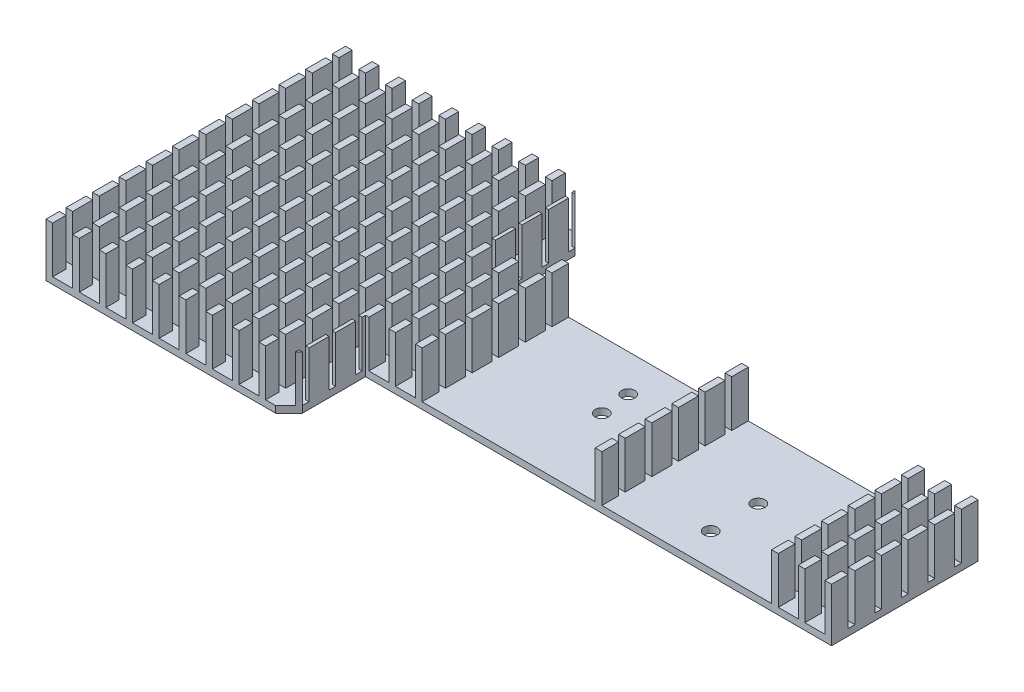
SolidWorks part; units mm, degrees
ref_plane "Plan de face" through (0, 0, 0) normal (0, 0, 1) x (1, 0, 0)
ref_plane "Plan de dessus" through (0, 0, 0) normal (0, 1, 0) x (1, 0, 0)
ref_plane "Plan de droite" through (0, 0, 0) normal (1, 0, 0) x (0, 0, -1)
sketch "Esquisse1" plane through (0, 0, 0) normal (0, 1, 0) x (1, 0, 0)
  line L0 (-33, 22) -> (-33, 19.5)
  line L1 (-40, 0) -> (-40, 19.5)
  line L2 (-33, 22) -> (30, 22)
  line L4 (30, 22) -> (30, 0)
  line L5 (-33, 19.5) -> (-40, 19.5)
  line L7 (-40, 0) -> (30, 0)
  dimension "D1" = 19.5
  dimension "D3" = 2.5
  dimension "D4" = 7
  dimension "D5" = 63
  dimension "D7" = 30
extrude "Boss.-Extru.1" add sketch "Esquisse1" along normal blind 1
sketch "Esquisse3" plane through (0, 1, 0) normal (0, 1, 0) x (1, 0, 0)
  line L0 (30, 0) -> (30, 22) construction
  line L1 (-40, -11.5) -> (-76.5, -11.5)
  line L2 (-40, 33.5) -> (-40, -11.5)
  line L3 (-40, 33.5) -> (-76.5, 33.5)
  line L4 (-76.5, -11.5) -> (-76.5, 33.5)
  line L6 (-33, 19.5) -> (-40, 19.5) construction
  line L7 (-40, 19.5) -> (-40, 0) construction
  dimension "D1" = 45
  dimension "D2" = 14
  dimension "D3" = 106.5
extrude "Boss.-Extru.2" add sketch "Esquisse3" against normal up to surface (1 mm away)
sketch "Esquisse4" plane through (0, 1, 0) normal (0, 1, 0) x (1, 0, 0)
  line L2 (30, 0) -> (30, 22) construction
  line L3 (-40, 0) -> (30, 0) construction
  circle A0 centre (7, 12) radius 1
  circle A1 centre (-16.5, 12) radius 1
  dimension "D1" = 2
  dimension "D2" = 2
  dimension "D3" = 23
  dimension "D4" = 23.5
  dimension "D5" = 12
extrude "Enlèv. mat.-Extru.2" cut sketch "Esquisse4" against normal through all
chamfer "Chanfrein3" distance 2 angle 45 2 edges at (-40, 0.5, -33.5) (-40, 0.5, 11.5)
sketch "Esquisse7" plane through (0, 0, 11.5) normal (0, 0, 1) x (1, 0, 0)
  line L0 (-76.5, 1) -> (-76.5, 15)
  line L3 (-75.5, 1) -> (-76.5, 1)
  line L4 (-75.5, 1) -> (-75.5, 15)
  line L5 (-75.5, 15) -> (-76.5, 15)
  dimension "D2" = 14
  dimension "D1" = 1
extrude "Boss.-Extru.3" add sketch "Esquisse7" against normal up to surface (45 mm away)
pattern_linear "Répétition linéaire1" count 12 spacing 4 along (1, 0, 0) of "Boss.-Extru.3"
sketch "Esquisse9" plane through (0, 1, 0) normal (0, -1, 0) x (1, 0, 0)
  line L0 (-33, -19.5) -> (-40, -19.5)
  line L1 (-40, -19.5) -> (-40, -31.5)
  line L2 (-40, -31.5) -> (-42, -33.5)
  line L3 (-40.5, -32) -> (-42, -33.5) construction
  line L4 (-42, -33.5) -> (30, -33.5)
  line L5 (30, -33.5) -> (30, -22)
  line L6 (30, -22) -> (-33, -22)
  line L7 (30, -22) -> (-31.5, -22) construction
  line L8 (-33, -22) -> (-33, -19.5)
  line L9 (-40, 0) -> (-40, 9.5)
  line L10 (-40, 9.5) -> (-42, 11.5)
  line L11 (-42, 11.5) -> (30, 11.5)
  line L13 (30, 11.5) -> (30, 0)
  line L14 (30, 0) -> (-40, 0)
  line L15 (-76.5, -33.5) -> (-42, -33.5) construction
extrude "Enlèv. mat.-Extru.3" cut sketch "Esquisse9" against normal through all
sketch "Esquisse10" plane through (0, 0, 0) normal (0, 0, 1) x (1, 0, 0)
  line L0 (30, 1) -> (30, 15)
  line L1 (30, 15) -> (29, 15)
  line L2 (29, 15) -> (29, 1)
  line L3 (-35.5, 1) -> (-32.5, 1) construction
  line L4 (29, 1) -> (30, 1)
  line L5 (-35.5, 15) -> (-36.5, 15) construction
  dimension "D1" = 1
extrude "Boss.-Extru.4" add sketch "Esquisse10" against normal up to surface (22 mm away)
pattern_linear "Répétition linéaire2" count 3 spacing 4 along (-1, 0, 0) of "Boss.-Extru.4"
sketch "Esquisse11" plane through (0, 1, 0) normal (0, 1, 0) x (1, 0, 0)
  circle A0 centre (-16.995, 16.45) radius 1
  circle A1 centre (6.995, 4.85) radius 1
  dimension "D1" = 2
  dimension "D2" = 2
extrude "Enlèv. mat.-Extru.4" cut sketch "Esquisse11" against normal through all
sketch "Esquisse12" plane through (0, 0, -22) normal (0, 0, -1) x (-1, 0, 0)
  line L0 (-21, 1) -> (31.5, 1) construction
  line L1 (4.5, 1) -> (5.5, 1)
  line L2 (4.5, 1) -> (4.5, 15)
  line L3 (4.5, 15) -> (5.5, 15)
  line L4 (5.5, 1) -> (5.5, 15)
  line L5 (5, 9.2012) -> (5, -0.9846) construction
  dimension "D1" = 1
  dimension "D2" = 14
extrude "Boss.-Extru.5" add sketch "Esquisse12" against normal up to surface (22 mm away)
sketch "Esquisse13" plane through (0, 0, 11.5) normal (0, 0, 1) x (1, 0, 0)
  line L5 (-76.5, 15) -> (30, 15)
  line L6 (-76.5, 15) -> (-76.5, 8)
  line L7 (-76.5, 8) -> (30, 8)
  line L8 (30, 15) -> (30, 8)
  dimension "D1" = 7
extrude "Enlèv. mat.-Extru.5" cut sketch "Esquisse13" against normal through all
sketch "Esquisse14" plane through (-76.5, 0, 0) normal (-1, 0, 0) x (0, 0, 1)
  line L0 (-33.5, 8) -> (11.5, 8) construction
  line L1 (-10.5, 1) -> (-11.5, 1)
  line L2 (-10.5, 1) -> (-10.5, 8)
  line L3 (-10.5, 8) -> (-11.5, 8)
  line L4 (-11.5, 1) -> (-11.5, 8)
  line L5 (-33.5, 1) -> (11.5, 1) construction
  line L7 (-11, 15.0867) -> (-11, -4.2913) construction
  dimension "D1" = 1
extrude "Enlèv. mat.-Extru.6" cut sketch "Esquisse14" against normal up to surface (106.5 mm away)
pattern_linear "Répétition linéaire3" count 6 spacing 4 along (0, 0, -1) of "Enlèv. mat.-Extru.6"
pattern_linear "Répétition linéaire4" count 6 spacing 4 along (0, 0, 1) of "Enlèv. mat.-Extru.6"
